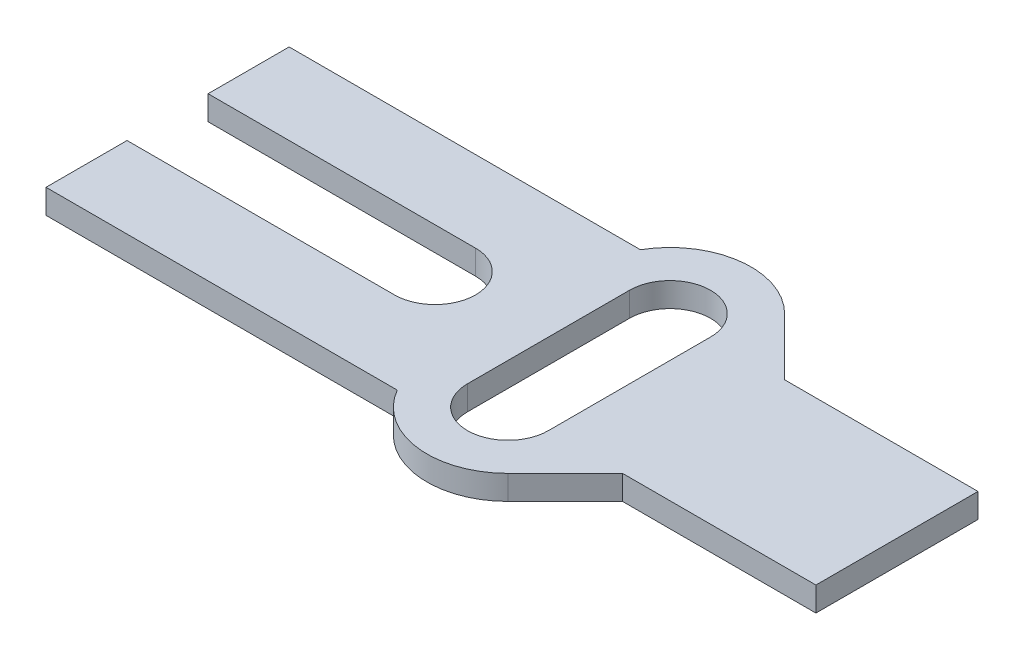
SolidWorks part; units mm, degrees
ref_plane "Front" through (0, 0, 0) normal (0, 0, 1) x (1, 0, 0)
ref_plane "Top" through (0, 0, 0) normal (0, 1, 0) x (1, 0, 0)
ref_plane "Right" through (0, 0, 0) normal (1, 0, 0) x (0, 0, -1)
sketch "Sketch1" plane through (0, 0, 0) normal (0, 1, 0) x (1, 0, 0)
  line L0 (0, 20) -> (33, 20)
  line L1 (0, 0) -> (43.3397, 0)
  line L2 (0, 0) -> (0, 10)
  line L3 (0, 30) -> (43.3397, 30)
  line L4 (90, 5) -> (90, 25)
  line L5 (0, 10) -> (33, 10)
  line L7 (0, 30) -> (90, 30) construction
  line L8 (0, 20) -> (0, 30)
  line L9 (66.1421, 25) -> (90, 25)
  line L10 (0, 20) -> (90, 20) construction
  line L11 (0, 10) -> (90, 10) construction
  line L12 (0, 0) -> (90, 0) construction
  line L13 (66.1421, 5) -> (90, 5)
  line L14 (59.0711, 32.0711) -> (66.1421, 25)
  line L15 (47, 25) -> (47, 5)
  line L16 (57, 25) -> (57, 5)
  line L18 (59.0711, -2.0711) -> (66.1421, 5)
  arc A0 (33, 10) -> (33, 20) centre (33, 15) ccw
  arc A1 (57, 25) -> (47, 25) centre (52, 25) ccw
  arc A2 (59.0711, 32.0711) -> (43.3397, 30) centre (52, 25) ccw
  arc A3 (47, 5) -> (57, 5) centre (52, 5) ccw
  arc A4 (43.3397, 0) -> (59.0711, -2.0711) centre (52, 5) ccw
extrude "Extrude1" add sketch "Sketch1" along normal blind 3
